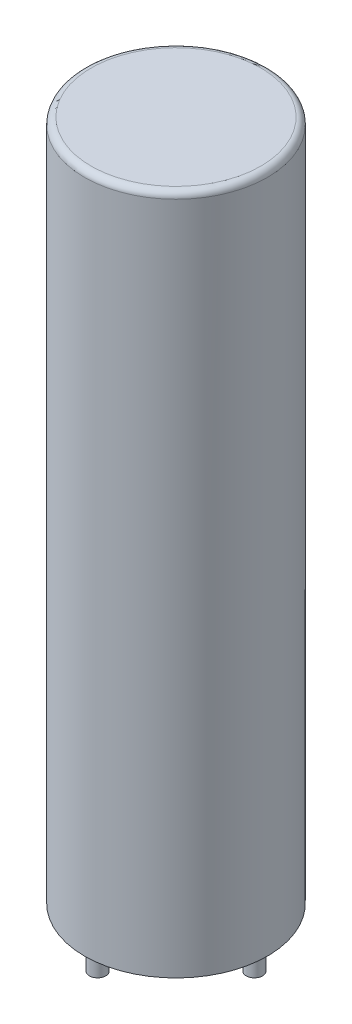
SolidWorks part; units mm, degrees
ref_plane "Front Plane" through (0, 0, 0) normal (0, 0, 1) x (1, 0, 0)
ref_plane "Top Plane" through (0, 0, 0) normal (0, 1, 0) x (1, 0, 0)
ref_plane "Right Plane" through (0, 0, 0) normal (1, 0, 0) x (0, 0, -1)
sketch "Sketch1" plane through (0, 0, 0) normal (0, 0, 1) x (1, 0, 0)
  line L0 (0, 0) -> (14, 0)
  line L1 (14, 0) -> (14, 120)
  line L2 (14, 120) -> (0, 120)
  line L3 (0, 120) -> (0, 0)
  dimension "D1" = 14
  dimension "D2" = 120
revolve "Revolve1" add sketch "Sketch1" angle 360 about L3
sketch "Sketch2" plane through (0, 0, 0) normal (0, -1, 0) x (1, 0, 0)
  circle A0 centre (0, 0) radius 7.5
  dimension "D1" = 15
extrude "Cut-Extrude1" cut sketch "Sketch2" against normal blind 15.8
sketch "Sketch4" plane through (0, 15.8, 0) normal (0, -1, 0) x (1, 0, 0)
  circle A0 centre (0, 0) radius 10
  dimension "D1" = 20
extrude "Cut-Extrude2" cut sketch "Sketch4" against normal blind 9
sketch "Sketch5" plane through (0, 0, 0) normal (0, 1, 0) x (1, 0, 0)
  circle A0 centre (0, 0) radius 14
extrude "Cut-Extrude3" cut sketch "Sketch5" along normal blind 15.8
sketch "Sketch6" plane through (0, 15.8, 0) normal (0, -1, 0) x (1, 0, 0)
  circle A0 centre (0, 12) radius 1.25
  circle A2 centre (12, 0) radius 1.25
  circle A3 centre (0, -12) radius 1.25
  circle A4 centre (-12, 0) radius 1.25
  point P14 (0, 0)
  dimension "D2" = 2.5
  dimension "D1" = 12
  dimension "D3" = 4
extrude "Boss-Extrude1" add sketch "Sketch6" along normal blind 3
fillet "Fillet1" radius 1 1 edges at (-14, 120, 0)
